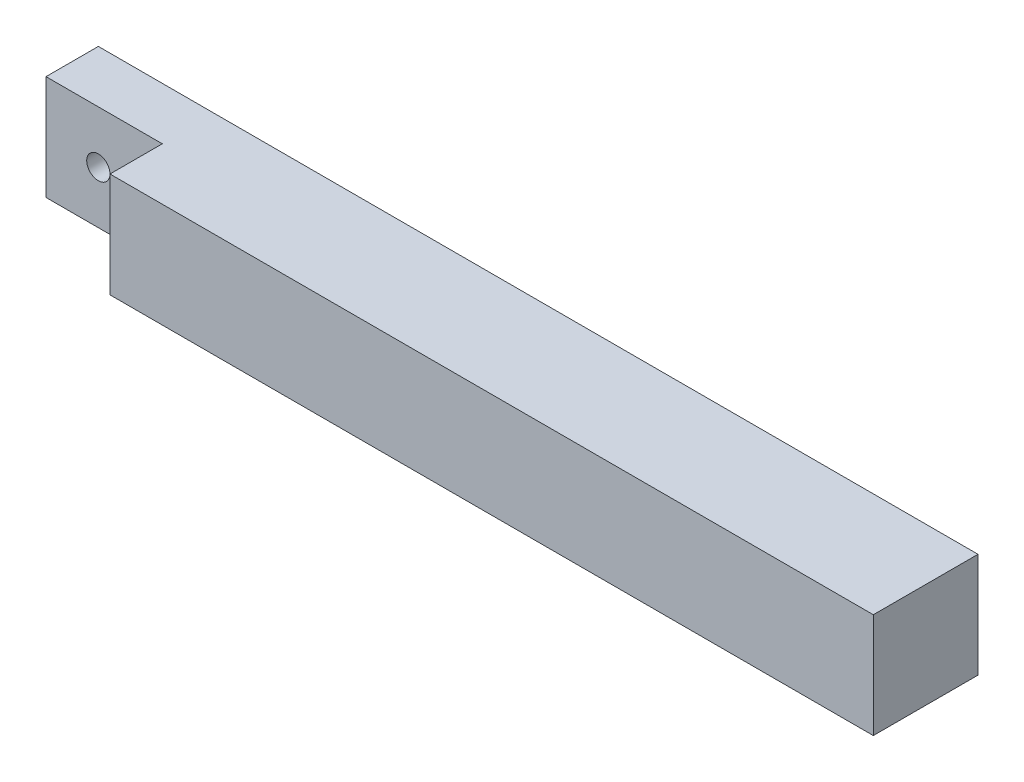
SolidWorks part; units mm, degrees
ref_plane "Plan de face" through (0, 0, 0) normal (0, 0, 1) x (1, 0, 0)
ref_plane "Plan de dessus" through (0, 0, 0) normal (0, 1, 0) x (1, 0, 0)
ref_plane "Plan de droite" through (0, 0, 0) normal (1, 0, 0) x (0, 0, -1)
sketch "Esquisse1" plane through (0, 0, 0) normal (0, 0, 1) x (1, 0, 0)
  line L1 (0, 0) -> (75.63, 0)
  line L2 (0, 0) -> (0, 9)
  line L3 (0, 9) -> (75.63, 9)
  line L4 (75.63, 0) -> (75.63, 9)
  dimension "D1" = 75.63
  dimension "D2" = 9
extrude "Extrusion1" add sketch "Esquisse1" along normal blind 9
sketch "Esquisse2" plane through (0, 0, 9) normal (0, 0, 1) x (1, 0, 0)
  line L0 (0, 0) -> (75.63, 0) construction
  line L1 (0, 9) -> (10, 9)
  line L2 (0, 9) -> (0, 0)
  line L3 (0, 0) -> (10, 0)
  line L4 (10, 9) -> (10, 0)
  dimension "D1" = 10
extrude "Enlèv. mat.-Extru.1" cut sketch "Esquisse2" against normal blind 4.5
sketch "Esquisse3" plane through (0, 0, 4.5) normal (0, 0, 1) x (1, 0, 0)
  line L0 (0, 9) -> (0, 0) construction
  line L1 (0, 0) -> (10, 0) construction
  circle A0 centre (4.5, 4.5) radius 1
  dimension "D3" = 2
  dimension "D1" = 4.5
  dimension "D2" = 4.5
extrude "Enlèv. mat.-Extru.2" cut sketch "Esquisse3" against normal blind 4.5
